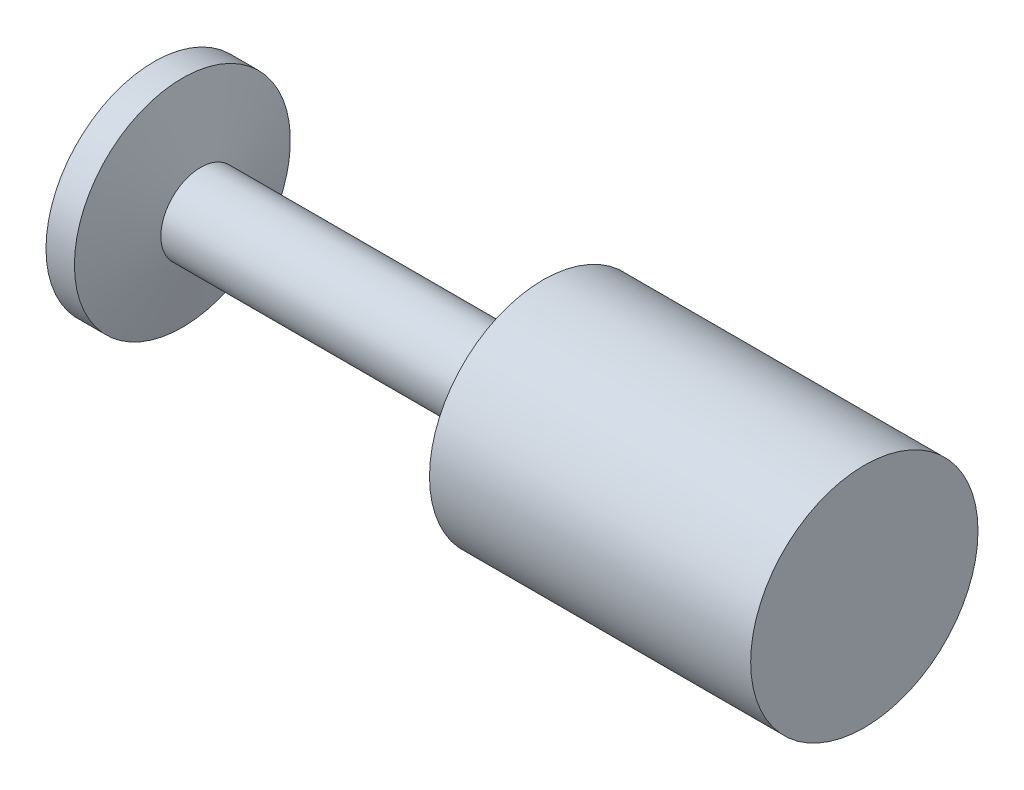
SolidWorks part; units mm, degrees
ref_plane "Plan de face" through (0, 0, 0) normal (0, 0, 1) x (1, 0, 0)
ref_plane "Plan de dessus" through (0, 0, 0) normal (0, 1, 0) x (1, 0, 0)
ref_plane "Plan de droite" through (0, 0, 0) normal (1, 0, 0) x (0, 0, -1)
sketch "Esquisse1" plane through (0, 0, 0) normal (0, 0, 1) x (1, 0, 0)
  line L0 (-18.0553, 0) -> (151.2116, 0) construction
  line L1 (0, 0) -> (0, 19)
  line L2 (0, 19) -> (5, 19)
  line L3 (5, 19) -> (8.2154, 7)
  line L4 (8.2154, 7) -> (65, 7)
  line L6 (125, 0) -> (0, 0)
  line L7 (65, 7) -> (68.4833, 20)
  line L8 (68.4833, 20) -> (125, 20)
  line L9 (125, 20) -> (125, 0)
  dimension "D1" = 38
  dimension "D2" = 40
  dimension "D3" = 105
  dimension "D4" = 5
  dimension "D5" = 125
  dimension "D6" = 65
  dimension "D7" = 105
  dimension "D8" = 14
revolve "Révolution1" add sketch "Esquisse1" angle 360 about L0
